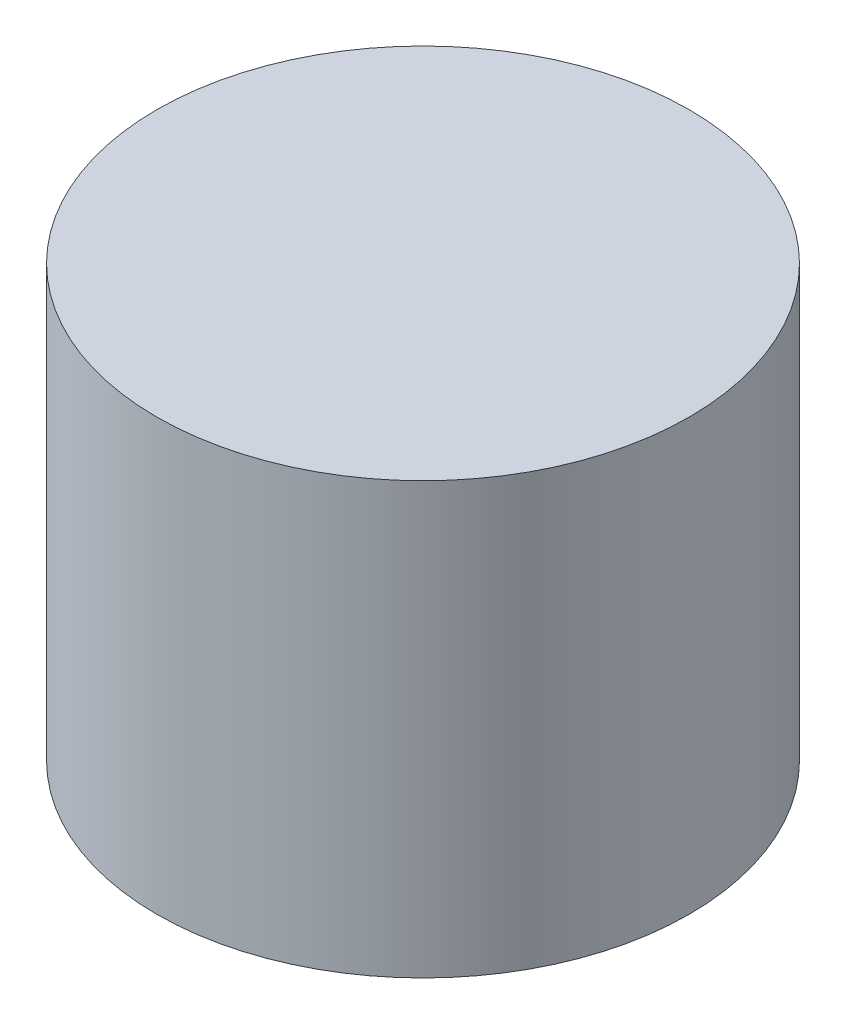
SolidWorks part; units mm, degrees
ref_plane "Front Plane" through (0, 0, 0) normal (0, 0, 1) x (1, 0, 0)
ref_plane "Top Plane" through (0, 0, 0) normal (0, 1, 0) x (1, 0, 0)
ref_plane "Right Plane" through (0, 0, 0) normal (1, 0, 0) x (0, 0, -1)
sketch "Sketch1" plane through (0, 0, 0) normal (0, 0, 1) x (1, 0, 0)
  line L0 (0, 0) -> (0, 3.74) construction
  line L2 (1.05, 2.75) -> (1.05, 0)
  line L3 (1.05, 0) -> (3.4, 0)
  line L4 (3.4, 0) -> (3.4, 5.5)
  line L5 (3.4, 5.5) -> (0, 5.5)
  line L6 (0, 5.5) -> (0, 4.15)
  line L7 (1.05, 2.75) -> (2.625, 2.75)
  line L8 (2.625, 2.75) -> (2.625, 4.15)
  line L9 (2.625, 4.15) -> (0, 4.15)
  dimension "D1" = 6.8
  dimension "D2" = 2.1
  dimension "D3" = 5.25
  dimension "D4" = 2.75
  dimension "D5" = 1.4
  dimension "D6" = 5.5
revolve "Revolve1" add sketch "Sketch1" angle 360 about L0
